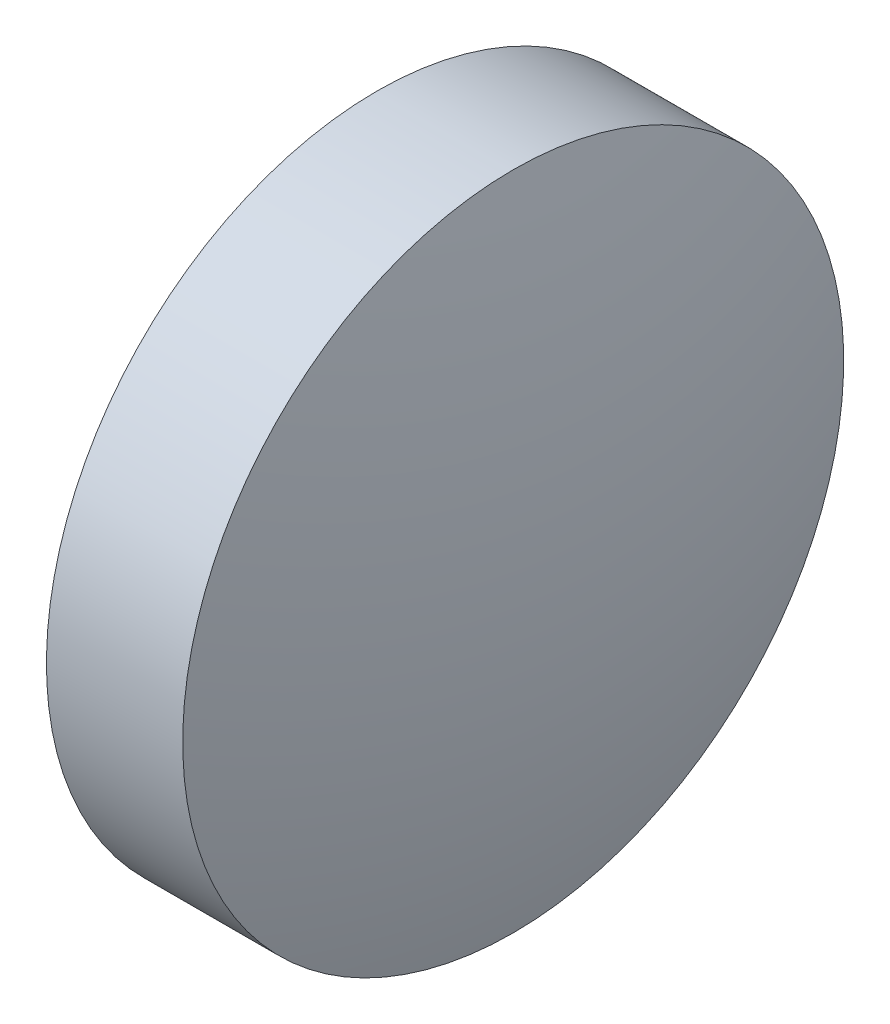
SolidWorks part; units mm, degrees
ref_plane "Front Plane" through (0, 0, 0) normal (0, 0, 1) x (1, 0, 0)
ref_plane "Top Plane" through (0, 0, 0) normal (0, 1, 0) x (1, 0, 0)
ref_plane "Right Plane" through (0, 0, 0) normal (1, 0, 0) x (0, 0, -1)
sketch "Sketch1" plane through (0, 0, 0) normal (0, 0, 1) x (1, 0, 0)
  line L0 (0, 0) -> (0, -24.638)
  line L1 (0, -24.638) -> (10.16, -24.638)
  line L2 (13.6058, 0) -> (0, 0)
  arc A0 (10.16, -24.638) -> (13.6058, 0) centre (-76.2, 0) ccw
  dimension "D1" = 24.638
  dimension "D2" = 76.2
  dimension "D3" = 10.16
revolve "Revolve1" add sketch "Sketch1" angle 360 about L2
